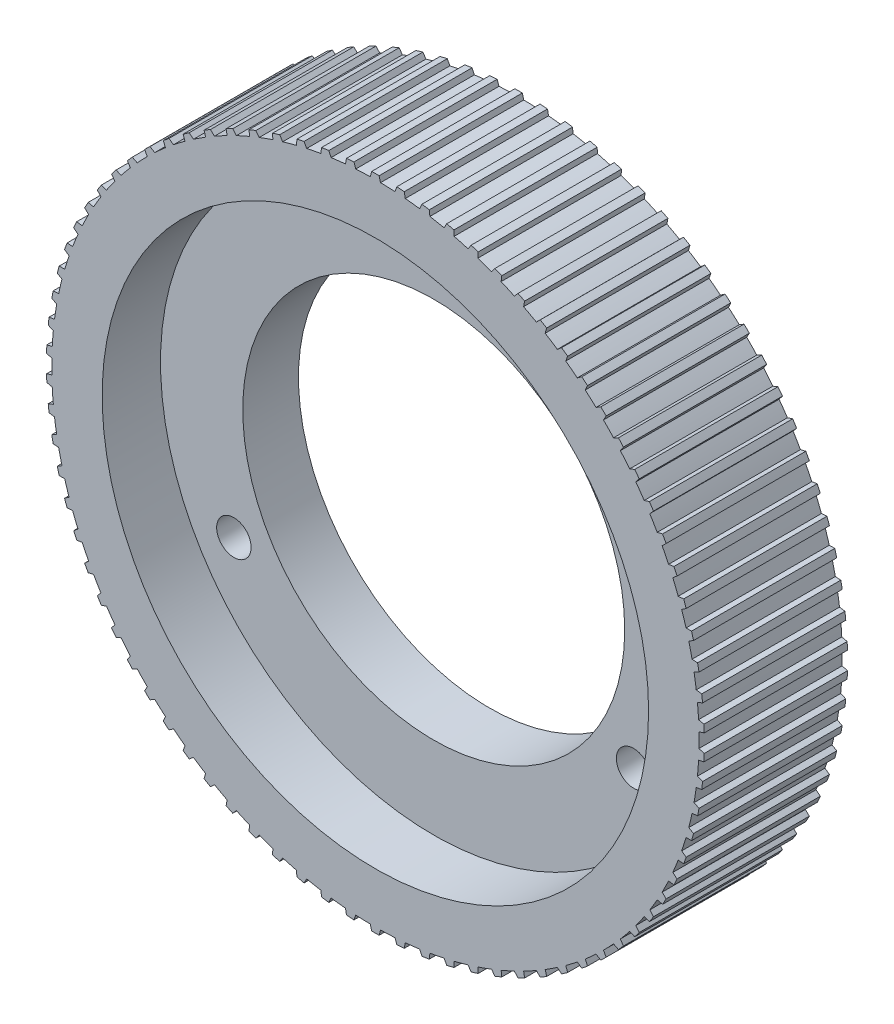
SolidWorks part; units mm, degrees
ref_plane "Face" through (0, 0, 0) normal (0, 0, 1) x (1, 0, 0)
ref_plane "Dessus" through (0, 0, 0) normal (0, 1, 0) x (1, 0, 0)
ref_plane "Droite" through (0, 0, 0) normal (1, 0, 0) x (0, 0, -1)
sketch "Esquisse1" plane through (0, 0, 0) normal (0, 0, 1) x (1, 0, 0)
  circle A0 centre (0, 0) radius 61.0024
  dimension "D1" = 122.0048
extrude "Base-Extrusion" add sketch "Esquisse1" against normal mid plane 27
sketch "Esquisse5" plane through (0, 0, 0) normal (0, 0, 1) x (1, 0, 0)
  line L0 (0.7021, 61.9984) -> (0.971, 60.9947)
  line L1 (-0.7021, 61.9984) -> (-0.971, 60.9947)
  line L8 (0, 61.5024) -> (0, 15.5499) construction
  arc A0 (0.7021, 61.9984) -> (-0.7021, 61.9984) centre (0, 0) ccw
  arc A1 (0.971, 60.9947) -> (-0.971, 60.9947) centre (0, 0) ccw
  arc A2 (-0.7021, 61.9984) -> (0.7021, 61.9984) centre (0, 0) ccw construction
  arc A3 (0.8365, 61.4967) -> (-0.8365, 61.4967) centre (0, 0) ccw construction
  circle A4 centre (0, 0) radius 61.0024 construction
  dimension "D7" = 123.0048
  dimension "D6" = 124.0048
  dimension "D2" = 1.673
  dimension "D1" = 15
extrude "Boss.-Extru.1" add sketch "Esquisse5" against normal up to surface and the other way up to surface
pattern_circular "Répétition circulaire1" count 82 over 360 about axis through (0, 0, 0) along (0, 0, 1) of "Boss.-Extru.1"
sketch "Esquisse6" plane through (0, 0, 13.5) normal (0, 0, 1) x (1, 0, 0)
  circle A0 centre (0, 0) radius 51.5
  dimension "D1" = 103
extrude "Enlèv. mat.-Extru.1" cut sketch "Esquisse6" against normal blind 11
sketch "Esquisse7" plane through (0, 0, 0) normal (0, 1, 0) x (1, 0, 0)
  line L0 (-49.25, 17.1187) -> (-49.25, 10.5)
  line L1 (-49.25, 10.5) -> (-48, 10.5)
  line L2 (-48, 10.5) -> (-48, 8)
  line L3 (-48, 8) -> (-36, 8)
  line L4 (0, -19.5436) -> (0, 17.1187)
  line L5 (0, 17.1187) -> (-49.25, 17.1187)
  line L6 (0, -44.3248) -> (0, 21.6039) construction
  line L7 (-36, 8) -> (-36, -19.5436)
  line L8 (-36, -19.5436) -> (0, -19.5436)
  dimension "D1" = 3
  dimension "D2" = 5.5
  dimension "D3" = 98.5
  dimension "D4" = 96
  dimension "D5" = 72
revolve "Enlèvement de matière-Révolution1" cut sketch "Esquisse7" angle 360 about L6
sketch "Esquisse8" plane through (0, 0, 2.5) normal (0, 0, 1) x (1, 0, 0)
  circle A0 centre (0, 43.5) radius 3.25
  dimension "D2" = 6.5
  dimension "D1" = 43.5
extrude "Enlèv. mat.-Extru.2" cut sketch "Esquisse8" against normal up to next
pattern_circular "Répétition circulaire2" count 3 every 120 about axis through (0, 0, 0) along (0, 0, 1) of "Enlèv. mat.-Extru.2"
